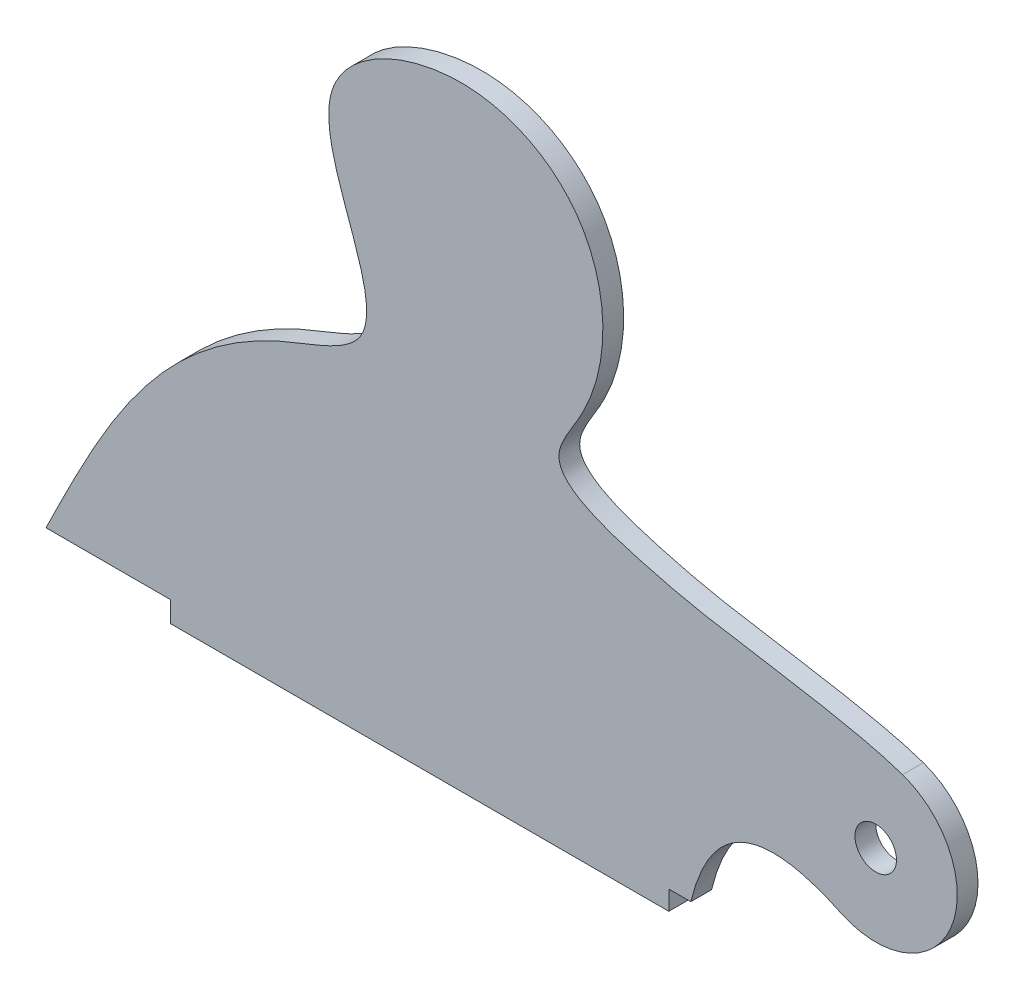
SolidWorks part; units mm, degrees
ref_plane "Front Plane" through (0, 0, 0) normal (0, 0, 1) x (1, 0, 0)
ref_plane "Top Plane" through (0, 0, 0) normal (0, 1, 0) x (1, 0, 0)
ref_plane "Right Plane" through (0, 0, 0) normal (1, 0, 0) x (0, 0, -1)
sketch "Sketch1" plane through (0, 0, 0) normal (0, 0, 1) x (1, 0, 0)
  line L0 (0, -35.2167) -> (0, -38.1717)
  line L1 (-76.2, -34.9967) -> (-76.2, -38.1717)
  line L2 (-95.25, -34.9967) -> (-76.2, -34.9967)
  line L3 (0, -35.2167) -> (3.3686, -35.2167)
  line L4 (-76.2, -38.1717) -> (0, -38.1717)
  circle A0 centre (31.6447, -13.9658) radius 3.175
  arc A1 (26.37, -25.265) -> (35.7604, -2.1947) centre (31.6447, -13.9658) ccw
  spline S0 degree 3 poles (-95.25, -34.9967) (-86.3745, -16.9258) (-76.4613, 3.2719) (-37.7444, 14.6873) (-62.6234, 45.4164) (-32.3658, 59.3939) (-9.4035, 48.2969) (-8.3789, 26.5525) (-20.4158, 11.0271) (-0.4022, 4.6296) (10.6192, 2.9674) (30.4175, -0.3266) (35.7604, -2.1947) knots 0 0 0 0 0.214842 0.264037 0.377829 0.464275 0.535465 0.637017 0.666025 0.720816 0.792706 0.855844 0.855844 0.855844 0.855844
  spline S1 degree 2 poles (3.3686, -35.2167) (7.9172, -16.4427) (26.37, -25.265) knots 0 0 0 1 1 1
  point P0 (0, 0)
extrude "Boss-Extrude1" add sketch "Sketch1" along normal blind 3.175
